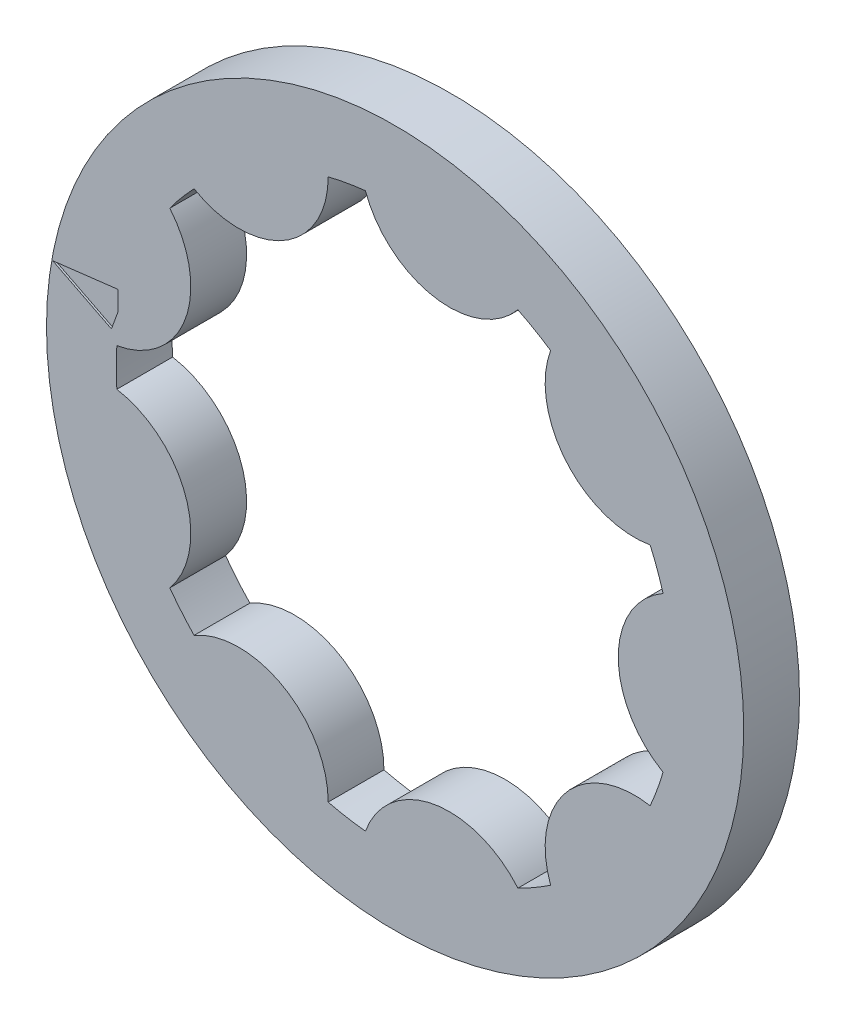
SolidWorks part; units mm, degrees
ref_plane "Plan1" through (0, 0, 0) normal (0, 0, 1) x (1, 0, 0)
ref_plane "Plan2" through (0, 0, 0) normal (0, 1, 0) x (1, 0, 0)
ref_plane "Plan3" through (0, 0, 0) normal (1, 0, 0) x (0, 0, -1)
sketch "Esquisse1" plane through (0, 0, 0) normal (0, 0, 1) x (1, 0, 0)
  line L0 (0, 0) -> (33.463, 0) construction
  line L1 (0, 0) -> (31.5811, 26.4997) construction
  arc A0 (9.1925, 7.7135) -> (13.7152, 6.0739) centre (12.8695, 10.7988) ccw
  arc A1 (14.4107, 4.1631) -> (13.7152, 6.0739) centre (0, 0) ccw
  arc A2 (13.7152, -6.0739) -> (9.1925, -7.7135) centre (12.8695, -10.7988) ccw
  arc A3 (14.4107, 4.1631) -> (12, 0) centre (16.8, 0) ccw
  arc A4 (13.7152, -6.0739) -> (14.4107, -4.1631) centre (0, 0) ccw
  arc A5 (12, 0) -> (14.4107, -4.1631) centre (16.8, 0) ccw
  arc A6 (6.6022, -13.4689) -> (2.0838, -11.8177) centre (2.9173, -16.5448) ccw
  arc A7 (6.6022, -13.4689) -> (8.3633, -12.4521) centre (0, 0) ccw
  arc A8 (9.1925, -7.7135) -> (8.3633, -12.4521) centre (12.8695, -10.7988) ccw
  arc A9 (-3.6, -14.5616) -> (-6, -10.3923) centre (-8.4, -14.5492) ccw
  arc A10 (-3.6, -14.5616) -> (-1.5974, -14.9147) centre (0, 0) ccw
  arc A11 (2.0838, -11.8177) -> (-1.5974, -14.9147) centre (2.9173, -16.5448) ccw
  arc A12 (-12.1178, -8.8408) -> (-11.2763, -4.1042) centre (-15.7868, -5.7459) ccw
  arc A13 (-12.1178, -8.8408) -> (-10.8107, -10.3985) centre (0, 0) ccw
  arc A14 (-6, -10.3923) -> (-10.8107, -10.3985) centre (-8.4, -14.5492) ccw
  arc A15 (-14.9655, 1.0167) -> (-11.2763, 4.1042) centre (-15.7868, 5.7459) ccw
  arc A16 (-14.9655, 1.0167) -> (-14.9655, -1.0167) centre (0, 0) ccw
  arc A17 (-11.2763, -4.1042) -> (-14.9655, -1.0167) centre (-15.7868, -5.7459) ccw
  arc A18 (-10.8107, 10.3985) -> (-6, 10.3923) centre (-8.4, 14.5492) ccw
  arc A19 (-10.8107, 10.3985) -> (-12.1178, 8.8408) centre (0, 0) ccw
  arc A20 (-11.2763, 4.1042) -> (-12.1178, 8.8408) centre (-15.7868, 5.7459) ccw
  arc A21 (-1.5974, 14.9147) -> (2.0838, 11.8177) centre (2.9173, 16.5448) ccw
  arc A22 (-1.5974, 14.9147) -> (-3.6, 14.5616) centre (0, 0) ccw
  arc A23 (-6, 10.3923) -> (-3.6, 14.5616) centre (-8.4, 14.5492) ccw
  arc A24 (8.3633, 12.4521) -> (9.1925, 7.7135) centre (12.8695, 10.7988) ccw
  arc A25 (8.3633, 12.4521) -> (6.6022, 13.4689) centre (0, 0) ccw
  arc A26 (2.0838, 11.8177) -> (6.6022, 13.4689) centre (2.9173, 16.5448) ccw
  circle A27 centre (0, 0) radius 18.75
  dimension "D1" = 37.5
  dimension "D2" = 30
  dimension "D4" = 9.6
  dimension "D5" = 40
extrude "Base-Extrusion" add sketch "Esquisse1" along normal blind 3
sketch "Esquisse2" plane through (0, 0, 3) normal (0, 0, 1) x (1, 0, 0)
  line L0 (0, 0) -> (-21.4787, 0) construction
  line L1 (0, 0) -> (-20.8027, 3.6681) construction
  line L2 (-18.4126, 3.2466) -> (-14.901, 3.6681)
  line L3 (-18.4126, 3.2466) -> (-15.2569, 1.6496)
  line L4 (-14.901, 3.6681) -> (-14.901, 2.6274)
  line L5 (-15.2569, 1.6496) -> (-14.901, 2.6274)
  point P7 (-15.4692, 0)
  dimension "D1" = 10
extrude "Enlèv. mat.-Extru.1" cut sketch "Esquisse2" against normal blind 0.1
